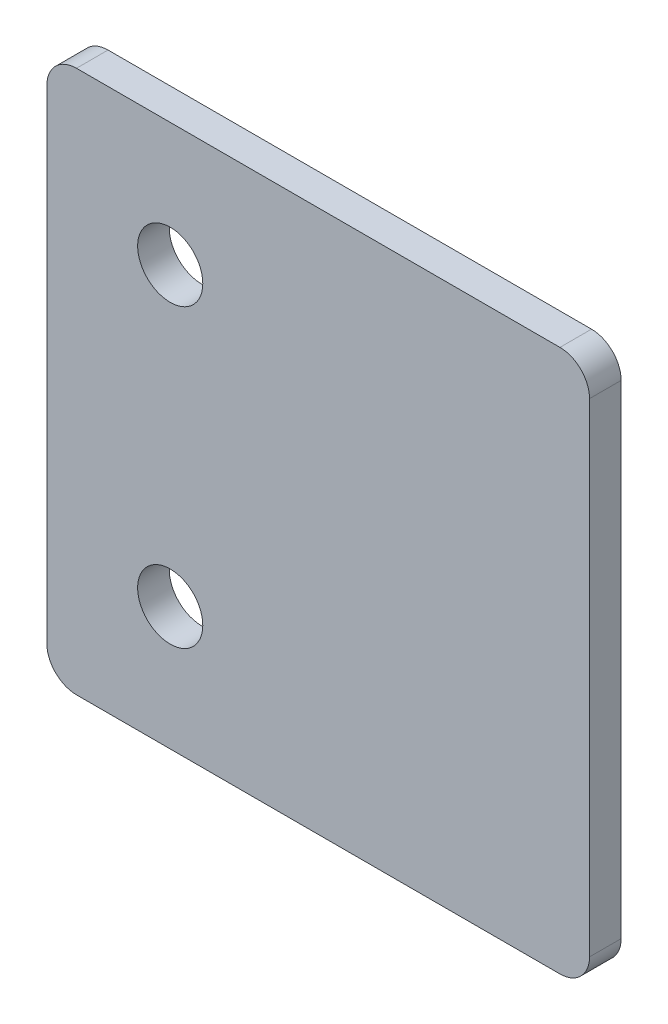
SolidWorks part; units mm, degrees
ref_plane "正面" through (0, 0, 0) normal (0, 0, 1) x (1, 0, 0)
ref_plane "平面" through (0, 0, 0) normal (0, 1, 0) x (1, 0, 0)
ref_plane "右側面" through (0, 0, 0) normal (1, 0, 0) x (0, 0, -1)
sketch "ｽｹｯﾁ1" plane through (0, 0, 0) normal (0, 0, 1) x (1, 0, 0)
  line L1 (3, 0) -> (52, 0)
  line L2 (0, 3) -> (0, 52)
  line L3 (3, 55) -> (52, 55)
  line L4 (55, 3) -> (55, 52)
  arc A0 (3, 55) -> (0, 52) centre (3, 52) ccw
  arc A1 (3, 0) -> (0, 3) centre (3, 3) cw
  arc A2 (55, 3) -> (52, 0) centre (52, 3) cw
  arc A3 (55, 52) -> (52, 55) centre (52, 52) ccw
  point P8 (0, 0)
  point P11 (55, 0)
  point P14 (55, 55)
  dimension "D3" = 3
  dimension "D1" = 55
  dimension "D2" = 55
extrude "押し出し1" add sketch "ｽｹｯﾁ1" along normal blind 3.2
hole_wizard "Ø6.6 (6.6) 直径の穴1" positions "3Dｽｹｯﾁ1" profile "ｽｹｯﾁ2" hole size "Ø6.6" standard "Jis"
sketch3d "3Dｽｹｯﾁ1"
  line L0 (0, 52, 3.2) -> (0, 3, 3.2) construction
  line L1 (3, 0, 3.2) -> (52, 0, 3.2) construction
  point P0 (12.5, 42.5, 3.2)
  point P2 (12.5, 12.5, 3.2)
  dimension "D1" = 12.5
  dimension "D2" = 12.5
  dimension "D3" = 30
sketch "ｽｹｯﾁ2" plane through (12.5, 42.5, 3.2) normal (1, 0, 0) x (0, -1, 0)
  line L0 (0, 0) -> (0, 61.9828)
  line L1 (0, 61.9828) -> (3.3, 60)
  line L2 (3.3, 60) -> (3.3, 0)
  line L5 (3.3, 0) -> (0, 0)
  line L10 (0, 61.9828) -> (-3.3, 60) construction
  line L11 (0, -6.35) -> (0, 107.95) construction
  dimension "穴の直径" = 6.6
  dimension "穴の深さ" = 60
  dimension "ﾄﾞﾘﾙ角度" = 118
